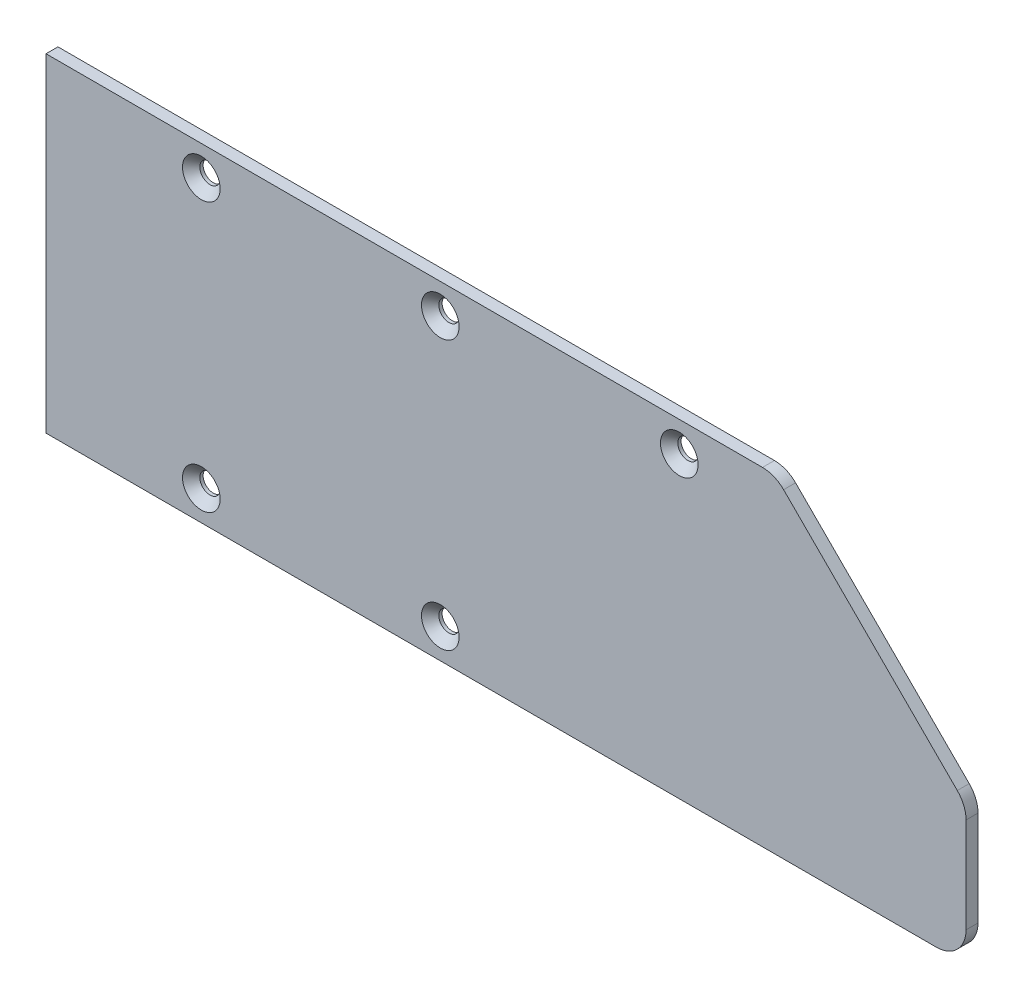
SolidWorks part; units mm, degrees
ref_plane "Face" through (0, 0, 0) normal (0, 0, 1) x (1, 0, 0)
ref_plane "Dessus" through (0, 0, 0) normal (0, 1, 0) x (1, 0, 0)
ref_plane "Profil" through (0, 0, 0) normal (1, 0, 0) x (0, 0, -1)
sketch "Esquisse1" plane through (0, 0, 0) normal (0, 0, 1) x (1, 0, 0)
  line L1 (0, 0) -> (154, 0)
  line L2 (0, 0) -> (0, 55)
  line L3 (0, 55) -> (154, 55)
  line L4 (154, 0) -> (154, 55)
  dimension "D1" = 154
  dimension "D2" = 55
extrude "Extrusion1" add sketch "Esquisse1" along normal blind 2
sketch "Esquisse2" plane through (0, 0, 2) normal (0, 0, 1) x (1, 0, 0)
  line L5 (122, 55) -> (154, 23)
  line L6 (154, 55) -> (0, 55) construction
  line L7 (154, 0) -> (154, 55) construction
  dimension "D1" = 32
  dimension "D2" = 45
extrude "Enlèv. mat.-Extru.1" cut sketch "Esquisse2" against normal through all and the other way through all
fillet "Congé1" radius 5 3 edges at (154, 23, 1) (154, 0, 1) (122, 55, 1)
hole_wizard "Fraisage pour vis à tête fraisée M31" positions "Esquisse4" profile "Esquisse3" countersink size "M3" standard "DIN"
sketch "Esquisse4" plane through (0, 0, 2) normal (0, 0, 1) x (1, 0, 0)
  line L0 (0, 0) -> (149, 0) construction
  line L1 (0, 55) -> (0, 0) construction
  point P0 (26, 5)
  dimension "D1" = 5
  dimension "D2" = 26
sketch "Esquisse3" plane through (26, 5, 2) normal (1, 0, 0) x (0, -1, 0)
  line L0 (0, 0) -> (0, 2)
  line L1 (0, 2) -> (1.7, 2)
  line L2 (1.7, 2) -> (1.7, 1.45)
  line L3 (1.7, 1.45) -> (3.15, 0)
  line L5 (3.15, 0) -> (0, 0)
  line L6 (-1.7, 1.45) -> (-3.15, 0) construction
  line L11 (0, -6.35) -> (0, 107.95) construction
  dimension "Diamètre du perçage jusqu'au prochain" = 3.4
  dimension "Profondeur du perçage jusqu'au prochain" = 2
  dimension "Diamètre du fraisage entrant" = 6.3
  dimension "Angle du fraisage entrant" = 90
pattern_linear "Répétition linéaire1" count 3 spacing 40 along (1, 0, 0) count 2 spacing 45 along (0, 1, 0) of "Fraisage pour vis à tête fraisée M31"
